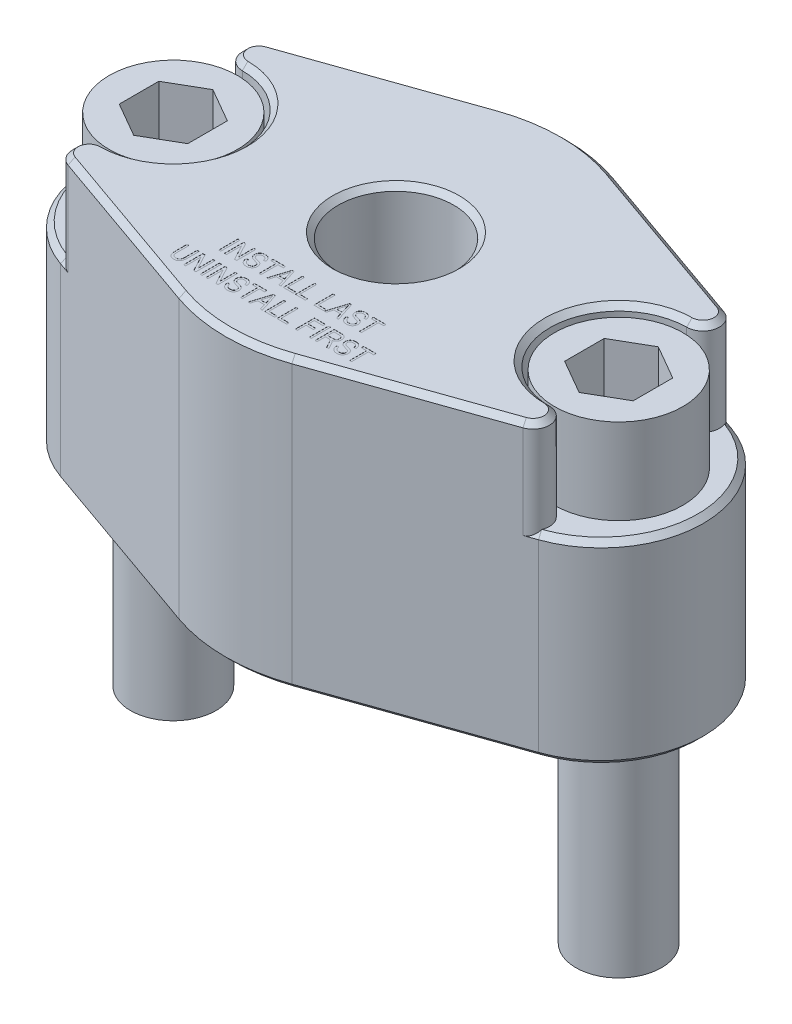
SolidWorks part; units mm, degrees
other "<SHCS31-18L1.50>-<HEX>"
ref_plane "Front Plane" through (0, 0, 0) normal (0, 0, 1) x (1, 0, 0)
ref_plane "Top Plane" through (0, 0, 0) normal (0, 1, 0) x (1, 0, 0)
ref_plane "Right Plane" through (0, 0, 0) normal (1, 0, 0) x (0, 0, -1)
sketch "Sketch1" plane through (0, 0, 0) normal (0, 1, 0) x (1, 0, 0)
  line L0 (-5.2297, 14.8812) -> (-22.1404, 8.9383)
  line L1 (-22.1404, -8.9383) -> (-5.2297, -14.8812)
  line L2 (5.2297, -14.8812) -> (22.1404, -8.9383)
  line L3 (22.1404, 8.9383) -> (5.2297, 14.8812)
  line L4 (-18.9992, 0) -> (18.9992, 0) construction
  line L5 (0, 0) -> (0, 22.9186) construction
  arc A0 (-5.2297, -14.8812) -> (5.2297, -14.8812) centre (0, 0) ccw
  arc A1 (-22.1404, 8.9383) -> (-22.1404, -8.9383) centre (-18.9992, 0) ccw
  arc A2 (22.1404, -8.9383) -> (22.1404, 8.9383) centre (18.9992, 0) ccw
  arc A3 (5.2297, 14.8812) -> (-5.2297, 14.8812) centre (0, 0) ccw
  circle A4 centre (-20.6375, 0) radius 4.3815
  circle A5 centre (20.6375, 0) radius 4.3815
  dimension "D1" = 31.5468
  dimension "D2" = 9.4742
  dimension "D3" = 56.9468
  dimension "D5" = 20.6375
  dimension "D6" = 8.763
  dimension "D4" = 19.363
extrude "Boss-Extrude1" add sketch "Sketch1" along normal blind 26.7208
sketch "Sketch2" plane through (0, 0, 0) normal (0, -1, 0) x (1, 0, 0)
  circle A0 centre (0, 0) radius 12.827
  dimension "D1" = 25.654
extrude "Cut-Extrude1" cut sketch "Sketch2" against normal blind 12.7
fillet "Fillet1" radius 0.508 1 edges at (0, 12.7, -12.827)
sketch "Sketch3" plane through (0, 26.7208, 0) normal (0, 1, 0) x (1, 0, 0)
  line L0 (-28.4734, 6.35) -> (-20.6375, 6.35)
  line L1 (-28.4734, -6.35) -> (-20.6375, -6.35)
  line L2 (-28.4734, 6.35) -> (-28.4734, -6.35)
  line L3 (20.6375, 6.35) -> (28.4734, 6.35)
  line L4 (28.4734, 6.35) -> (28.4734, -6.35)
  line L5 (28.4734, -6.35) -> (20.6375, -6.35)
  arc A0 (-20.6375, -6.35) -> (-20.6375, 6.35) centre (-20.6375, 0) ccw
  arc A1 (20.6375, 6.35) -> (20.6375, -6.35) centre (20.6375, 0) ccw
  arc A2 (-22.1404, 8.9383) -> (-22.1404, -8.9383) centre (-18.9992, 0) ccw construction
  arc A3 (22.1404, -8.9383) -> (22.1404, 8.9383) centre (18.9992, 0) ccw construction
  dimension "D1" = 12.7
extrude "Cut-Extrude2" cut sketch "Sketch3" against normal blind 8.636
fillet "Fillet2" radius 1.524 4 edges at (-26.0304, 22.4028, 6.35) (-26.0304, 22.4028, -6.35) (26.0304, 22.4028, 6.35) (26.0304, 22.4028, -6.35)
hole_wizard "1/2-13 Tapped Hole1" positions "Sketch4" profile "Sketch5" tap size "1/2-13" standard "ANSI Inch"
sketch "Sketch4" plane through (0, 26.7208, 0) normal (0, 1, 0) x (1, 0, 0)
  point P0 (0, 0)
sketch "Sketch5" plane through (0, 26.7208, 0) normal (1, 0, 0) x (0, 0, 1)
  line L0 (0, 0) -> (0, 26.7208)
  line L1 (0, 26.7208) -> (5.3581, 26.7208)
  line L2 (5.3581, 26.7208) -> (5.3581, 0)
  line L5 (5.3581, 0) -> (0, 0)
  line L11 (0, -6.35) -> (0, 107.95) construction
  dimension "Thru Tap Drill Dia." = 10.7163
  dimension "Thru Tap Drill Depth" = 26.7208
chamfer "Chamfer1" distance 0.508 angle 45 30 edges at (13.154, 26.7208, -12.0964) (13.154, 26.7208, 12.0964) (0, 26.7208, 15.7734) (-13.154, 26.7208, 12.0964) (-13.154, 26.7208, -12.0964) (0, 26.7208, -15.7734) (14.2875, 26.7208, 0) (-14.2875, 26.7208, 0) (0, 26.7208, 5.3581) (20.6375, 0, 4.3815) (0, 0, -12.827) (-20.6375, 0, 4.3815) (13.685, 0, -11.9098) (0, 0, -15.7734) (28.4734, 0, 0) (-13.685, 0, -11.9098) (13.685, 0, 11.9098) (-28.4734, 0, 0) (0, 0, 15.7734) (-13.685, 0, 11.9098) (-22.0764, 26.7208, 7.6236) (-22.0764, 26.7208, -7.6236) (22.0764, 26.7208, -7.6236) (22.0764, 26.7208, 7.6236) (21.6094, 18.0848, 9.1249) (21.6094, 18.0848, -9.1249) (28.4734, 18.0848, 0) (-21.6094, 18.0848, -9.1249) (-21.6094, 18.0848, 9.1249) (-28.4734, 18.0848, 0)
sketch "Sketch6" plane through (0, 26.7208, 0) normal (0, 1, 0) x (1, 0, 0)
  line L0 (-9.525, -9.652) -> (9.525, -9.652) construction
  line L1 (0, 15.2654) -> (0, -15.7734) construction
  line L3 (-9.525, -12.446) -> (9.525, -12.446) construction
  arc A0 (5.0613, 14.4019) -> (-5.0613, 14.4019) centre (0, 0) ccw construction
  arc A1 (-5.2297, -14.8812) -> (5.2297, -14.8812) centre (0, 0) ccw construction
  text T0 "INSTALL LAST" font "Arial Narrow" height 1.778
  text T2 "UNINSTALL FIRST" font "Arial Narrow" height 1.778
  point P14 (0, -9.652)
  dimension "D2" = 19.05
  dimension "D5" = 9.652
  dimension "D6" = 12.446
extrude "Cut-Extrude3" cut sketch "Sketch6" against normal blind 0.0127
inserted part "SHCS31-18L1.50"
move or copy body "Body-Move/Copy2" placed by mates yes parameters "D1"=0, "D2"=0, "D3"=0
mirror "Mirror1" about plane through (0, 0, 0) normal (1, 0, 0)
